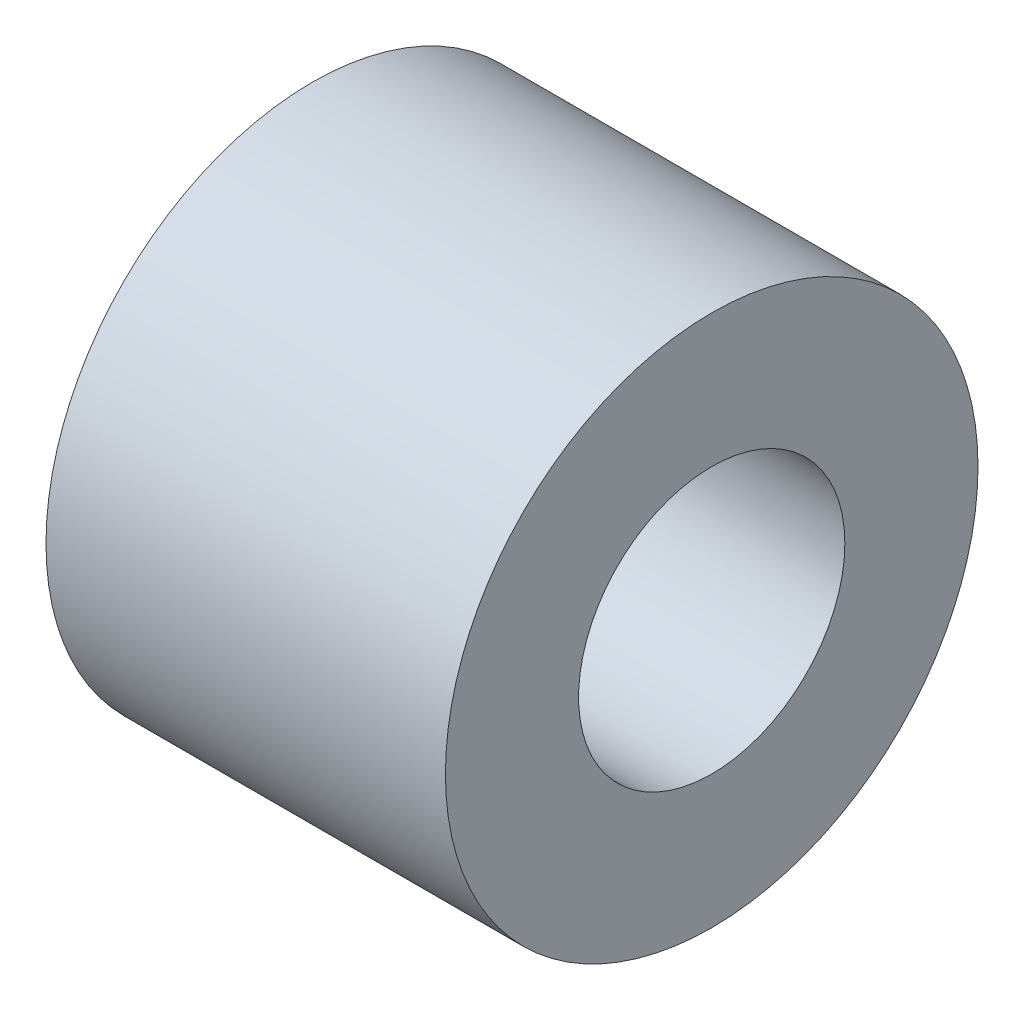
SolidWorks part; units mm, degrees
ref_plane "Plan de face" through (0, 0, 0) normal (0, 0, 1) x (1, 0, 0)
ref_plane "Plan de dessus" through (0, 0, 0) normal (0, 1, 0) x (1, 0, 0)
ref_plane "Plan de droite" through (0, 0, 0) normal (1, 0, 0) x (0, 0, -1)
sketch "Esquisse1" plane through (0, 0, 0) normal (1, 0, 0) x (0, 0, -1)
  circle A0 centre (0, -1.3418) radius 1
  circle A1 centre (0, -1.3418) radius 2
extrude "Boss.-Extru.1" add sketch "Esquisse1" along normal blind 3
